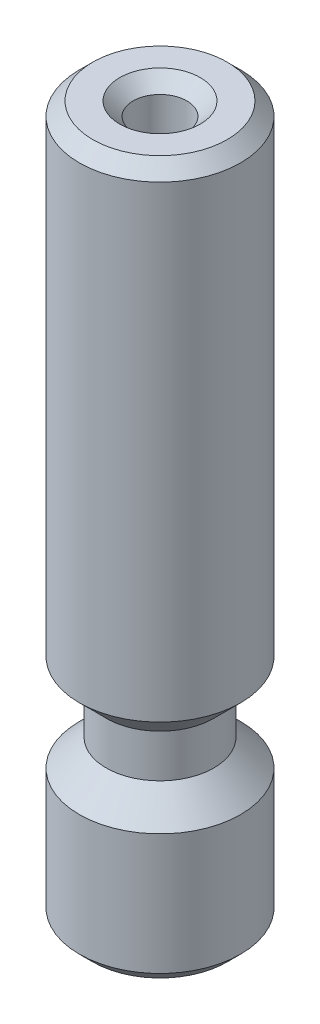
SolidWorks part; units mm, degrees
ref_plane "Front Plane" through (0, 0, 0) normal (0, 0, 1) x (1, 0, 0)
ref_plane "Top Plane" through (0, 0, 0) normal (0, 1, 0) x (1, 0, 0)
ref_plane "Right Plane" through (0, 0, 0) normal (1, 0, 0) x (0, 0, -1)
sketch "Sketch1" plane through (0, 0, 0) normal (0, 1, 0) x (1, 0, 0)
  circle A0 centre (0, 0) radius 3
  dimension "D1" = 6
extrude "Boss-Extrude1" add sketch "Sketch1" along normal blind 26.5
sketch "Sketch3" plane through (0, 26.5, 0) normal (0, 1, 0) x (1, 0, 0)
  circle A0 centre (0, 0) radius 1
  dimension "D1" = 2
extrude "Cut-Extrude1" cut sketch "Sketch3" against normal through all
chamfer "Chamfer1" distance 0.5 3 edges at (0, 0, 3) (0, 26.5, 1) (0, 26.5, 3)
sketch "Sketch4" plane through (0, 0, 0) normal (0, 0, 1) x (1, 0, 0)
  line L0 (0, 0) -> (0, 26.5) construction
  line L1 (1.5, 26.5) -> (-1.5, 26.5) construction
  line L2 (3, 8.6) -> (2, 7.6)
  line L3 (3, 0.5) -> (3, 26) construction
  line L4 (2, 7.6) -> (2, 6)
  line L5 (2, 6) -> (3, 5)
  line L6 (3, 5) -> (3, 8.6)
  dimension "D1" = 1.6
  dimension "D2" = 3.6
  dimension "D3" = 1
  dimension "D4" = 4.5
revolve "Cut-Revolve1" cut sketch "Sketch4" angle 360 about L0
